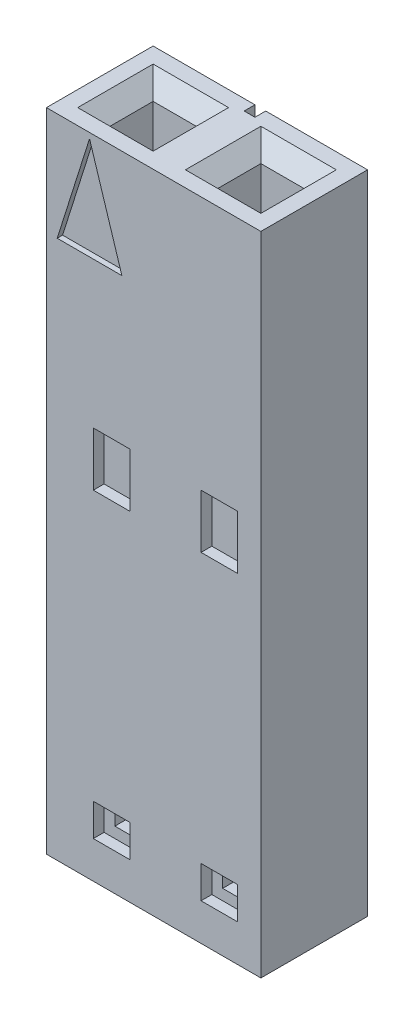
SolidWorks part; units mm, degrees
ref_plane "Front Plane" through (0, 0, 0) normal (0, 0, 1) x (1, 0, 0)
ref_plane "Top Plane" through (0, 0, 0) normal (0, 1, 0) x (1, 0, 0)
ref_plane "Right Plane" through (0, 0, 0) normal (1, 0, 0) x (0, 0, -1)
imported_body "Imported1"
sketch "Sketch1" plane through (0, 0, -1.2573) normal (0, 0, -1) x (-1, 0, 0)
  line L6 (-2.5273, -7.112) -> (2.5273, -7.112)
  line L7 (-2.2733, -7.112) -> (-0.254, -7.112)
  line L9 (-2.2733, -7.62) -> (-2.2733, 7.62)
  line L10 (-2.2733, -7.62) -> (-2.2733, -7.112)
  line L11 (0, -7.62) -> (0, 7.62) construction
  line L12 (2.2733, 7.62) -> (2.2733, -7.62)
  line L13 (2.2733, -7.112) -> (2.2733, -7.62)
  line L14 (-2.5273, -7.62) -> (2.5273, -7.62) construction
  line L15 (-2.5273, 7.62) -> (2.5273, 7.62) construction
  line L16 (-0.254, -7.62) -> (-0.254, -7.112)
  line L17 (0.254, -7.62) -> (0.254, -7.112)
  line L18 (0.254, -7.62) -> (0.254, 7.62) construction
  line L19 (-0.254, -7.62) -> (-0.254, 7.62) construction
  line L20 (0.254, -7.112) -> (2.2733, -7.112)
  line L21 (-2.2733, -7.62) -> (-0.254, -7.62)
  line L22 (0.254, -7.62) -> (2.2733, -7.62)
  dimension "D1" = 0.508
  dimension "D2" = 0.254
  dimension "D3" = 0.254
  dimension "D4" = 0.254
  dimension "D5" = 0.254
extrude "Extrude1" cut sketch "Sketch1" against normal blind 1.778
sketch "Sketch2" plane through (0, 0, -1.2573) normal (0, 0, -1) x (-1, 0, 0)
  line L0 (0, 7.62) -> (0, -7.62) construction
  line L1 (-2.5273, 7.62) -> (2.5273, 7.62) construction
  line L2 (-0.254, -7.62) -> (0.254, -7.62) construction
  line L3 (0.127, 7.62) -> (0.127, 1.778)
  line L4 (-0.127, 7.62) -> (-0.127, 1.778)
  line L5 (-2.5273, 1.778) -> (2.5273, 1.778)
  line L6 (-0.127, 1.778) -> (0.127, 1.778)
  line L7 (0.127, 7.62) -> (0.127, -7.62) construction
  line L8 (-0.127, 7.62) -> (-0.127, -7.62) construction
  line L9 (0.127, 7.62) -> (-0.127, 7.62)
  dimension "D1" = 5.842
  dimension "D2" = 0.127
  dimension "D3" = 0.127
extrude "Extrude2" cut sketch "Sketch2" against normal blind 0.254
sketch "Sketch3" plane through (0, -7.112, 0) normal (0, -1, 0) x (1, 0, 0)
  line L0 (-0.762, 0) -> (-1.778, 0) construction
  line L1 (-0.762, -0.508) -> (-0.762, 0.508) construction
  line L2 (-1.778, 0.508) -> (-1.778, -0.508) construction
  line L3 (-1.27, -0.508) -> (-1.27, 0.508) construction
  line L4 (-1.778, -0.508) -> (-0.762, -0.508) construction
  line L5 (-0.762, 0.508) -> (-1.778, 0.508) construction
  circle A0 centre (-1.27, 0) radius 0.521
sketch "Sketch4" plane through (0, -7.112, 0) normal (0, -1, 0) x (1, 0, 0)
  line L0 (1.27, 0.508) -> (1.27, -0.508) construction
  line L1 (1.778, 0.508) -> (0.762, 0.508) construction
  line L2 (0.762, -0.508) -> (1.778, -0.508) construction
  line L3 (0.762, 0) -> (1.778, 0) construction
  line L4 (0.762, 0.508) -> (0.762, -0.508) construction
  line L5 (1.778, -0.508) -> (1.778, 0.508) construction
  circle A0 centre (1.27, 0) radius 0.508
sketch "Sketch5" plane through (0, 0, 1.2573) normal (0, 0, 1) x (1, 0, 0)
  line L0 (-2.5273, -7.62) -> (-2.5273, 7.62) construction
  line L1 (2.5273, -7.62) -> (2.5273, 7.62) construction
  line L2 (-1.5113, 5.08) -> (-1.5113, 7.493) construction
  line L3 (-1.5113, 7.493) -> (-2.2733, 5.08)
  line L6 (-2.5273, 5.08) -> (2.5273, 5.08)
  line L7 (-2.2733, 5.08) -> (-0.7493, 5.08)
  line L10 (-0.7493, 5.08) -> (-1.5113, 7.493)
  dimension "D1" = 1.016
  dimension "D2" = 0.254
  dimension "D5" = 3.2766
  dimension "D3" = 2.54
extrude "Extrude5" cut sketch "Sketch5" against normal blind 0.127
sketch "Sketch6" plane through (0, 0, 1.0033) normal (0, 0, 1) x (1, 0, 0)
  line L8 (-1.4224, -5.9868) -> (-1.4224, -6.7488) construction
  line L9 (-1.4224, -6.7488) -> (-0.5588, -6.7488) construction
  line L10 (-0.5588, -5.9868) -> (-1.4224, -5.9868) construction
  line L11 (-0.5588, -6.7488) -> (-0.5588, -5.9868) construction
  line L12 (1.9812, -5.9868) -> (1.1176, -5.9868) construction
  line L13 (1.1176, -6.7488) -> (1.9812, -6.7488) construction
  line L14 (1.9812, -6.7488) -> (1.9812, -5.9868) construction
  line L24 (-0.8128, -6.2408) -> (-1.1684, -6.2408)
  line L25 (-1.1684, -6.2408) -> (-1.1684, -6.4948)
  line L26 (-1.1684, -6.4948) -> (-0.8128, -6.4948)
  line L27 (-0.8128, -6.4948) -> (-0.8128, -6.2408)
  line L36 (1.7272, -6.2408) -> (1.3716, -6.2408)
  line L37 (1.3716, -6.2408) -> (1.3716, -6.4948)
  line L38 (1.3716, -6.4948) -> (1.7272, -6.4948)
  line L39 (1.7272, -6.4948) -> (1.7272, -6.2408)
  point P18 (1.5494, -6.7488)
  dimension "D1" = 0.254
  dimension "D2" = 0.254
  dimension "D3" = 0.254
  dimension "D4" = 2.1844
  dimension "D5" = 0.254
  dimension "D6" = 0.254
  dimension "D7" = 0.254
  dimension "D8" = 0.254
extrude "Extrude7" cut sketch "Sketch6" against normal blind 1.397
